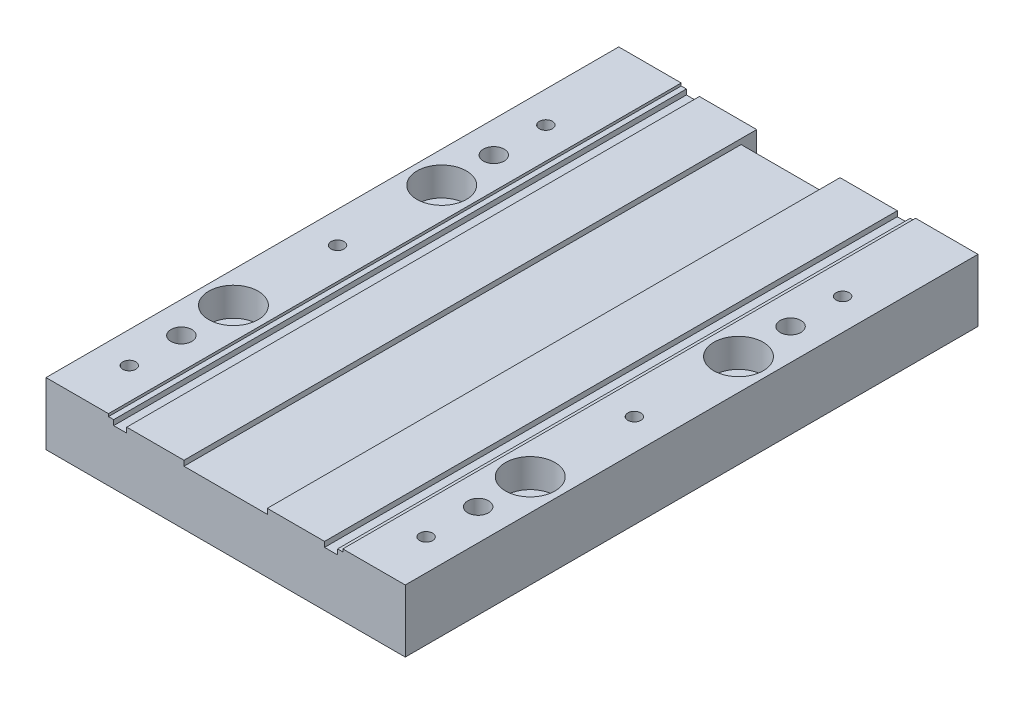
SolidWorks part; units mm, degrees
ref_plane "前视基准面" through (0, 0, 0) normal (0, 0, 1) x (1, 0, 0)
ref_plane "上视基准面" through (0, 0, 0) normal (0, 1, 0) x (1, 0, 0)
ref_plane "右视基准面" through (0, 0, 0) normal (1, 0, 0) x (0, 0, -1)
sketch "草图1" plane through (0, 0, 0) normal (0, 0, 1) x (1, 0, 0)
  line L0 (26.5, 10.5) -> (42.5, 10.5)
  line L1 (12, 11.5) -> (13, 11.5)
  line L2 (0, 12) -> (12, 12)
  line L3 (0, 0) -> (69, 0)
  line L4 (26.5, 10.5) -> (26.5, 11.5)
  line L5 (42.5, 10.5) -> (42.5, 11.5)
  line L6 (12, 11.5) -> (12, 12)
  line L7 (57, 11.5) -> (57, 12)
  line L8 (69, 0) -> (69, 12)
  line L9 (0, 0) -> (0, 12)
  line L10 (57, 12) -> (69, 12)
  line L11 (42.5, 11.5) -> (53.5, 11.5)
  line L12 (13, 11.5) -> (13, 10.5)
  line L13 (15.5, 11.5) -> (15.5, 10.5)
  line L14 (53.5, 11.5) -> (53.5, 10.5)
  line L15 (56, 11.5) -> (56, 10.5)
  line L16 (13, 10.5) -> (15.5, 10.5)
  line L17 (53.5, 10.5) -> (56, 10.5)
  line L18 (15.5, 11.5) -> (26.5, 11.5)
  line L19 (56, 11.5) -> (57, 11.5)
extrude "凸台-拉伸1" add sketch "草图1" along normal blind 110
sketch "草图2" plane through (0, 12, 0) normal (0, 1, 0) x (1, 0, 0)
  circle A0 centre (6, -20) radius 1.25
  circle A1 centre (6, -60) radius 1.25
  circle A2 centre (6, -100) radius 1.25
  circle A3 centre (63, -100) radius 1.25
  circle A4 centre (63, -60) radius 1.25
  circle A5 centre (63, -20) radius 1.25
  circle A6 centre (6, -30) radius 2
  circle A7 centre (6, -90) radius 2
  circle A8 centre (63, -90) radius 2
  circle A9 centre (63, -30) radius 2
  circle A10 centre (6, -80) radius 2.75
  circle A11 centre (63, -80) radius 2.75
  circle A12 centre (63, -40) radius 2.75
  circle A13 centre (6, -40) radius 2.75
extrude "切除-拉伸1" cut sketch "草图2" against normal blind 110
sketch "草图3" plane through (0, 12, 0) normal (0, 1, 0) x (1, 0, 0)
  circle A0 centre (6, -80) radius 4.75
  circle A1 centre (63, -80) radius 4.75
  circle A2 centre (63, -40) radius 4.75
  circle A3 centre (6, -40) radius 4.75
extrude "切除-拉伸2" cut sketch "草图3" against normal blind 5.5
chamfer "倒角1" distance 3 angle 45 1 edges at (34.5, 10.5, 0)
